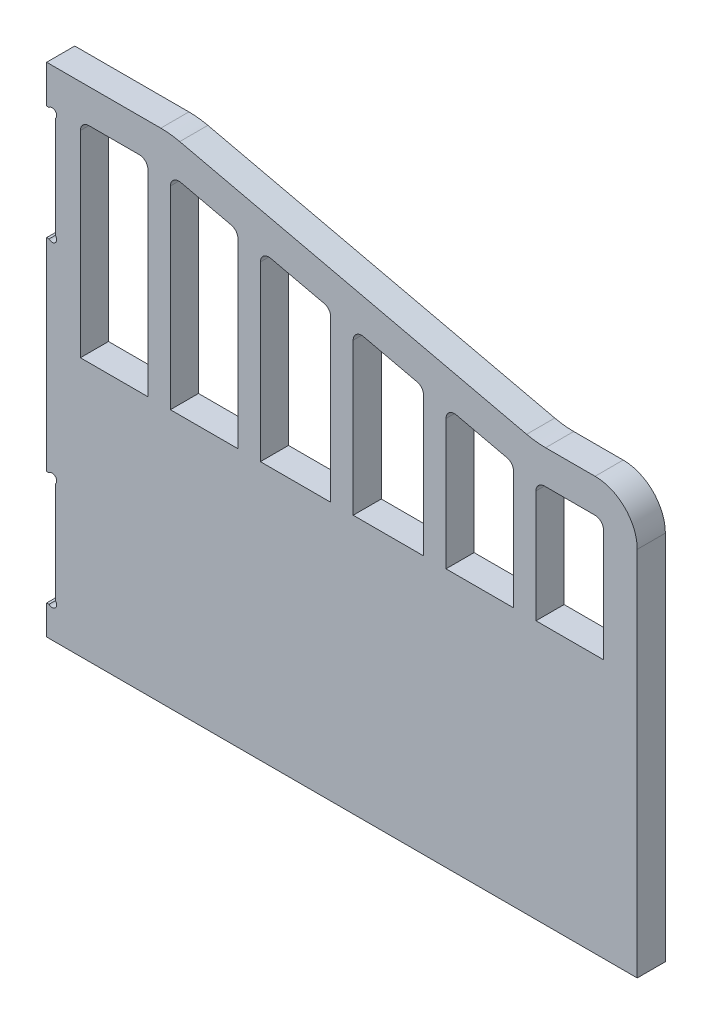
SolidWorks part; units mm, degrees
ref_plane "Plan de face" through (0, 0, 0) normal (0, 0, 1) x (1, 0, 0)
ref_plane "Plan de dessus" through (0, 0, 0) normal (0, 1, 0) x (1, 0, 0)
ref_plane "Plan de droite" through (0, 0, 0) normal (1, 0, 0) x (0, 0, -1)
sketch "Esquisse1" plane through (0, 0, 0) normal (0, 0, 1) x (1, 0, 0)
  line L0 (-85.5227, 0) -> (236.5689, 0) construction
  line L1 (0, -28.7692) -> (0, 254.4288) construction
  line L2 (-85.5227, 180) -> (236.5689, 180) construction
  line L3 (-45.0185, 95) -> (236.5689, 95) construction
  line L4 (210, -28.7692) -> (210, 254.4288) construction
  line L5 (105, 230.4357) -> (105, 76.72) construction
  line L6 (277.6881, 150) -> (174, 150) construction
  line L7 (6.3462, 168) -> (236.5689, 168) construction
  line L8 (12, -28.7692) -> (12, 178.8848) construction
  line L9 (101, 76.72) -> (101, 219.8493) construction
  line L10 (36, 76.72) -> (36, 204.576) construction
  line L11 (44, 76.72) -> (44, 204.576) construction
  line L12 (68, 76.72) -> (68, 204.576) construction
  line L13 (76, 76.72) -> (76, 204.576) construction
  line L14 (-68.3336, 90) -> (-26.0493, 90) construction
  line L15 (3.1, 164.2373) -> (3.1, 128.2627)
  line L16 (0.8373, 166.5) -> (0, 166.5)
  line L17 (0.8373, 126) -> (0, 126)
  line L18 (177.4166, 150) -> (195, 150)
  line L19 (40.5834, 180) -> (0, 180)
  line L20 (0, 180) -> (0, 166.5)
  line L21 (0, 126) -> (0, 54)
  line L22 (198, -28.7692) -> (198, 178.8848) construction
  line L23 (12, 95) -> (36, 95)
  line L24 (12, 95) -> (12, 165)
  line L25 (15, 168) -> (33, 168)
  line L26 (36, 95) -> (36, 165)
  line L27 (-34.5318, 3) -> (277.6881, 3) construction
  line L28 (109, 76.72) -> (109, 219.8493) construction
  line L29 (134, 76.72) -> (134, 204.576) construction
  line L30 (142, 76.72) -> (142, 204.576) construction
  line L31 (166, 76.72) -> (166, 204.576) construction
  line L32 (174, 76.72) -> (174, 204.576) construction
  line L33 (44, 163.9135) -> (44, 95)
  line L34 (210, 3) -> (210, 135)
  line L35 (-34.5318, 79) -> (6.3462, 79) construction
  line L36 (-21.6628, 13.5) -> (6.3462, 13.5) construction
  line L37 (-21.6628, 33.75) -> (6.3462, 33.75) construction
  line L38 (3.1, 4.139) -> (3.1, 57.9772) construction
  line L39 (3.1, 13.5) -> (-8.3596, 24.9596) construction
  line L40 (0.8373, 54) -> (0, 54)
  line L41 (0.8373, 13.5) -> (0, 13.5)
  line L42 (3.1, 15.7627) -> (3.1, 51.7373)
  line L43 (0, 13.5) -> (0, 3)
  line L44 (174, 95) -> (198, 95)
  line L45 (170.6709, 150.7683) -> (47.3291, 179.2317)
  line L46 (236.5689, 138) -> (172.6333, 138) construction
  line L47 (172.6333, 138) -> (25.1588, 172.0326) construction
  line L48 (174, 95) -> (174, 135)
  line L49 (0, 3) -> (210, 3)
  line L50 (177, 138) -> (195, 138)
  line L51 (198, 95) -> (198, 135)
  line L52 (44, 95) -> (68, 95)
  line L53 (68, 95) -> (68, 159.7596)
  line L54 (65.6746, 162.6828) -> (47.6746, 166.8366)
  line L55 (76, 156.5288) -> (76, 95)
  line L56 (76, 95) -> (101, 95)
  line L57 (101, 95) -> (101, 152.1442)
  line L58 (98.6746, 155.0674) -> (79.6746, 159.452)
  line L59 (112.6746, 151.8366) -> (131.6746, 147.452)
  line L60 (134, 144.5288) -> (134, 95)
  line L61 (134, 95) -> (109, 95)
  line L62 (109, 95) -> (109, 148.9135)
  line L63 (142, 141.2981) -> (142, 95)
  line L64 (142, 95) -> (166, 95)
  line L65 (166, 95) -> (166, 137.1442)
  line L66 (163.6746, 140.0674) -> (145.6746, 144.2213)
  arc A0 (0.8373, 126) -> (3.1, 128.2627) centre (1.9686, 127.1314) ccw
  arc A1 (0.8373, 166.5) -> (3.1, 164.2373) centre (1.9686, 165.3686) cw
  arc A2 (195, 138) -> (198, 135) centre (195, 135) cw
  arc A3 (195, 150) -> (210, 135) centre (195, 135) cw
  arc A4 (47.3291, 179.2317) -> (40.5834, 180) centre (40.5834, 150) ccw
  arc A5 (170.6709, 150.7683) -> (177.4166, 150) centre (177.4166, 180) ccw
  arc A6 (12, 165) -> (15, 168) centre (15, 165) cw
  arc A7 (0.8373, 13.5) -> (3.1, 15.7627) centre (1.9686, 14.6314) ccw
  arc A8 (0.8373, 54) -> (3.1, 51.7373) centre (1.9686, 52.8686) cw
  arc A9 (33, 168) -> (36, 165) centre (33, 165) cw
  arc A10 (44, 163.9135) -> (47.6746, 166.8366) centre (47, 163.9135) cw
  arc A11 (68, 159.7596) -> (65.6746, 162.6828) centre (65, 159.7596) ccw
  arc A12 (76, 156.5288) -> (79.6746, 159.452) centre (79, 156.5288) cw
  arc A13 (101, 152.1442) -> (98.6746, 155.0674) centre (98, 152.1442) ccw
  arc A14 (112.6746, 151.8366) -> (109, 148.9135) centre (112, 148.9135) ccw
  arc A15 (131.6746, 147.452) -> (134, 144.5288) centre (131, 144.5288) cw
  arc A16 (142, 141.2981) -> (145.6746, 144.2213) centre (145, 141.2981) cw
  arc A17 (166, 137.1442) -> (163.6746, 140.0674) centre (163, 137.1442) ccw
  arc A18 (174, 135) -> (177, 138) centre (177, 135) cw
  point P105 (198, 138)
  point P108 (210, 150)
  point P111 (44, 180)
  point P119 (36, 168)
  point P122 (44, 167.6846)
  point P125 (68, 162.1462)
  point P128 (76, 160.3)
  point P131 (101, 154.5308)
  point P134 (109, 152.6846)
  point P137 (134, 146.9154)
  point P140 (142, 145.0692)
  point P143 (166, 139.5308)
  dimension "D17" = 10.5
  dimension "D22" = 3
  dimension "D23" = 15
  dimension "D24" = 30
  dimension "D25" = 3
  dimension "D1" = 180
  dimension "D2" = 76
  dimension "D3" = 105
  dimension "D4" = 150
  dimension "D5" = 95
  dimension "D6" = 12
  dimension "D7" = 12
  dimension "D8" = 4
  dimension "D9" = 8
  dimension "D10" = 8
  dimension "D11" = 24
  dimension "D12" = 24
  dimension "D13" = 20.25
  dimension "D14" = 3
  dimension "D15" = 3.1
  dimension "D16" = 45
  dimension "D18" = 90
  dimension "D19" = 12
  dimension "D20" = 12
  dimension "D21" = 210
extrude "Boss.-Extru.1" add sketch "Esquisse1" along normal blind 10
sketch "Esquisse2" plane through (0, 0, 0) normal (0, 0, -1) x (-1, 0, 0)
  line L0 (8.7927, 95) -> (-40.8876, 95) construction
  line L1 (8.7927, 87) -> (-157.0883, 87) construction
  line L2 (8.7927, 81) -> (-157.0883, 81) construction
  line L3 (-55, 87) -> (-67.9803, 74.0197) construction
  line L4 (-55, 57.0385) -> (-55, 85.7692) construction
  line L5 (0, -7.5152) -> (0, 142.3625) construction
  line L6 (-32.2683, 84) -> (-105.324, 84) construction
  line L7 (-75, 61.1429) -> (-75, 82.1209) construction
  line L8 (-95, 84.7373) -> (-95, 83.2627)
  line L9 (-92.7373, 81) -> (-57.2627, 81)
  line L10 (-55, 83.2627) -> (-55, 84.7373)
  line L11 (-57.2627, 87) -> (-92.7373, 87)
  line L12 (0, 126) -> (0, 54) construction
  arc A0 (-55, 84.7373) -> (-57.2627, 87) centre (-56.1314, 85.8686) ccw
  arc A1 (-55, 83.2627) -> (-57.2627, 81) centre (-56.1314, 82.1314) cw
  arc A2 (-95, 84.7373) -> (-92.7373, 87) centre (-93.8686, 85.8686) cw
  arc A3 (-95, 83.2627) -> (-92.7373, 81) centre (-93.8686, 82.1314) ccw
  dimension "D1" = 3
  dimension "D2" = 6
  dimension "D3" = 20
  dimension "D4" = 8
  dimension "D5" = 55
  dimension "D6" = 45
extrude "Enlèv. mat.-Extru.1" cut sketch "Esquisse2" against normal blind 5
